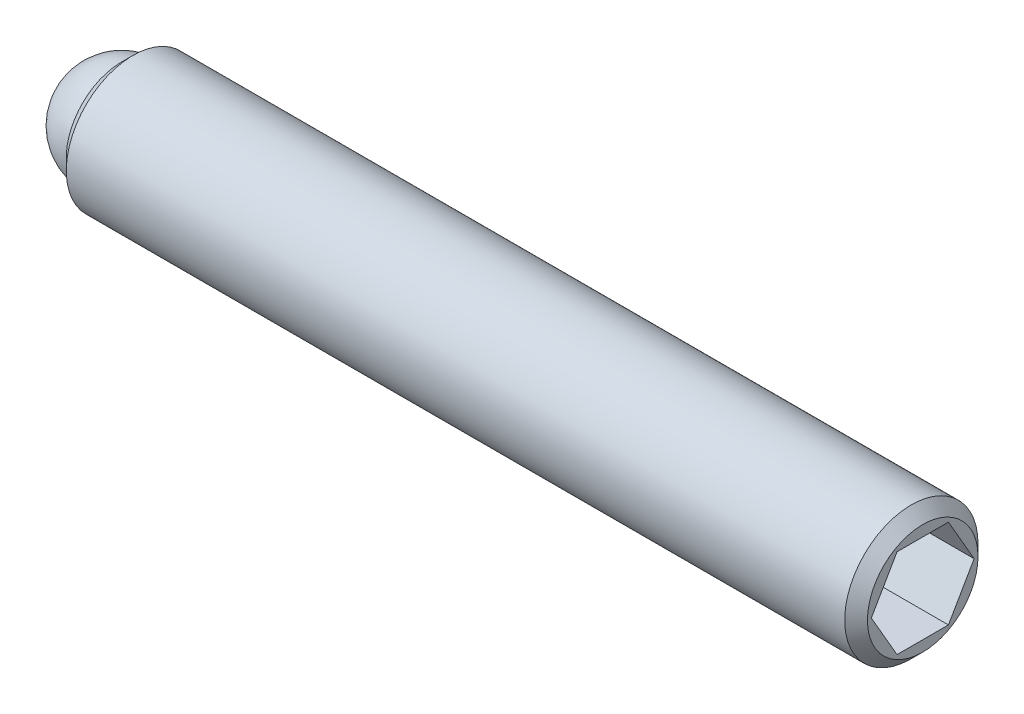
SolidWorks part; units mm, degrees
ref_plane "Front Plane" through (0, 0, 0) normal (0, 0, 1) x (1, 0, 0)
ref_plane "Top Plane" through (0, 0, 0) normal (0, 1, 0) x (1, 0, 0)
ref_plane "Right Plane" through (0, 0, 0) normal (1, 0, 0) x (0, 0, -1)
sketch "Sketch2" plane through (0, 0, 0) normal (1, 0, 0) x (0, 0, -1)
  circle A0 centre (0, 0) radius 1.4859
  dimension "D1" = 2.9718
extrude "Boss-Extrude1" add sketch "Sketch2" along normal blind 17.8594
sketch "Sketch3" plane through (0, 0, 0) normal (-1, 0, 0) x (0, 0, 1)
  circle A0 centre (0, 0) radius 1.1906
  dimension "D1" = 2.3813
chamfer "Chamfer1" distance 0.254 angle 45 1 edges at (0, 0, -1.4859)
chamfer "Chamfer2" distance 0.254 angle 45 1 edges at (17.8594, 0, -1.4859)
sketch "Sketch4" plane through (17.8594, 0, 0) normal (1, 0, 0) x (0, 0, -1)
  line L1 (1.1457, 0) -> (0.5728, 0.9922)
  line L2 (0.5728, 0.9922) -> (-0.5728, 0.9922)
  line L3 (-0.5728, 0.9922) -> (-1.1457, 0)
  line L4 (-1.1457, 0) -> (-0.5728, -0.9922)
  line L5 (-0.5728, -0.9922) -> (0.5728, -0.9922)
  line L6 (0.5728, -0.9922) -> (1.1457, 0)
  circle A0 centre (0, 0) radius 0.9922 construction
extrude "Cut-Extrude2" cut sketch "Sketch4" against normal blind 2.286
extrude "Cut-Extrude3" cut sketch "Sketch3" against normal blind 1.1906
sketch "Sketch5" plane through (0, 0, 0) normal (-1, 0, 0) x (0, 0, 1)
  line L0 (0, 0) -> (0, -1.1906)
  line L1 (0, 0) -> (0, 1.1906)
  arc A0 (0, 1.1906) -> (0, -1.1906) centre (0, 0) ccw
  dimension "D1" = 1.1906
revolve "Revolve1" add sketch "Sketch5" angle 360 about L1
